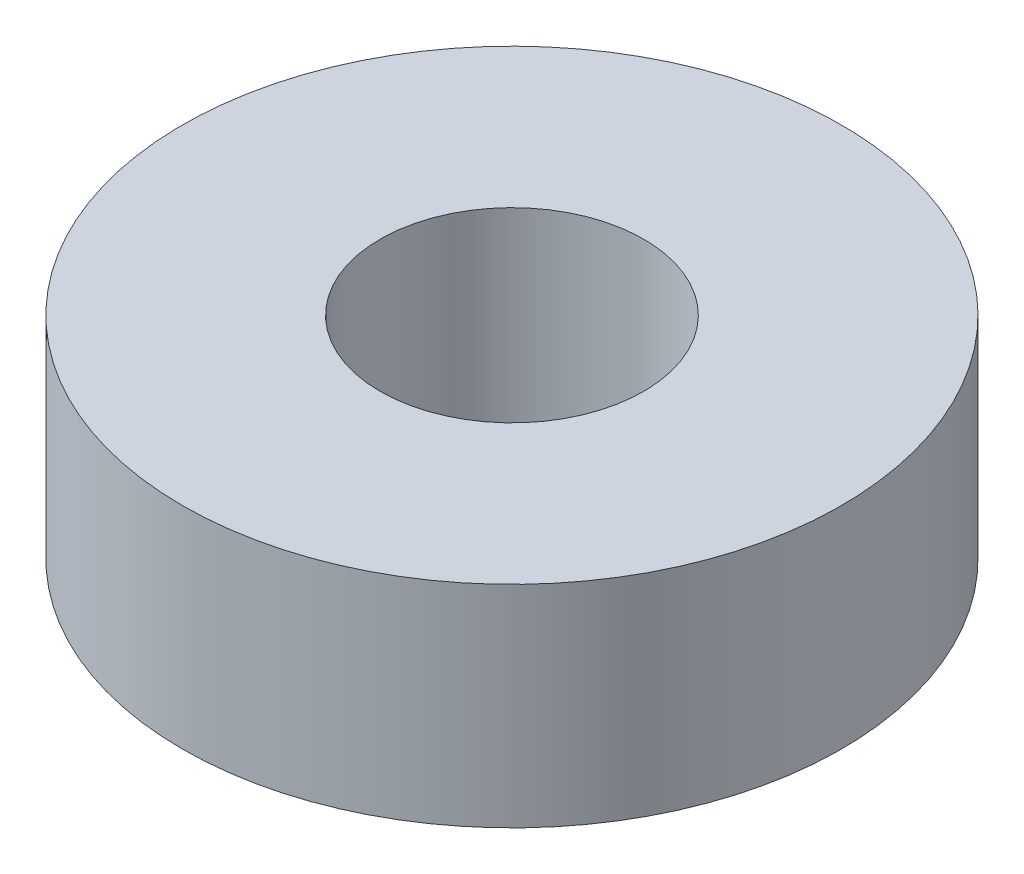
SolidWorks part; units mm, degrees
ref_plane "Front Plane" through (0, 0, 0) normal (0, 0, 1) x (1, 0, 0)
ref_plane "Top Plane" through (0, 0, 0) normal (0, 1, 0) x (1, 0, 0)
ref_plane "Right Plane" through (0, 0, 0) normal (1, 0, 0) x (0, 0, -1)
sketch "Sketch1" plane through (0, 0, 0) normal (0, 1, 0) x (1, 0, 0)
  circle A0 centre (0, 0) radius 7.9375
  circle A1 centre (0, 0) radius 3.175
  dimension "D1" = 6.35
  dimension "D2" = 15.875
extrude "Extrude1" add sketch "Sketch1" along normal blind 5.08
